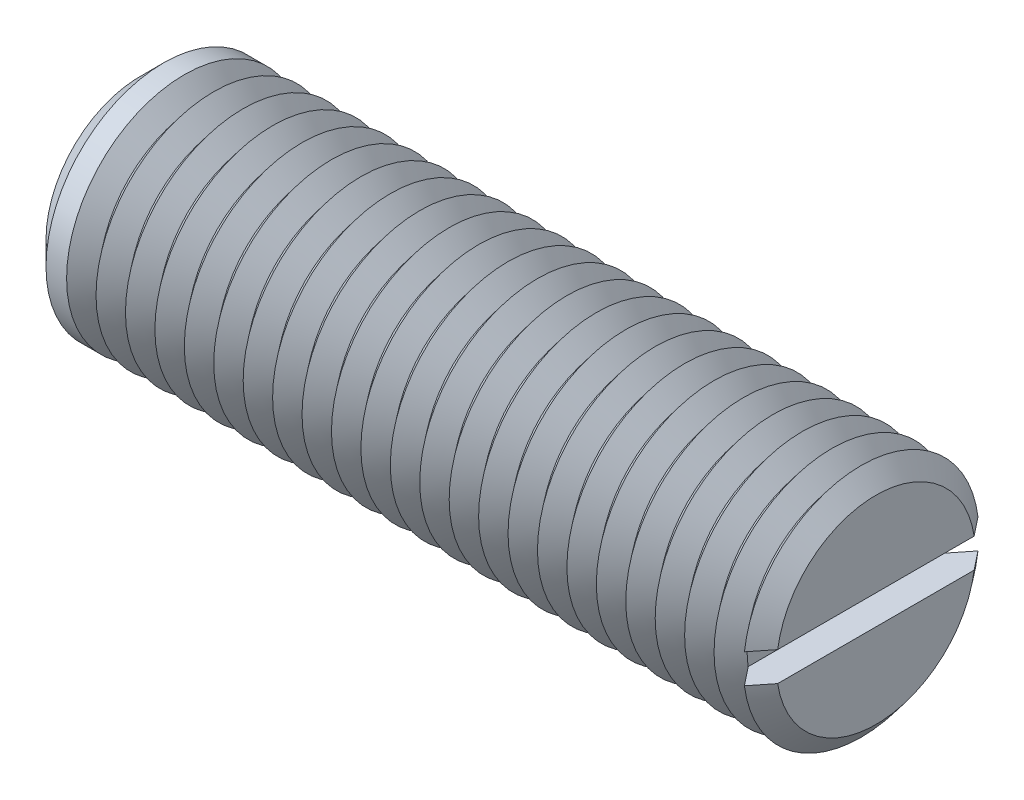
SolidWorks part; units mm, degrees
ref_plane "Front Plane" through (0, 0, 0) normal (0, 0, 1) x (1, 0, 0)
ref_plane "Top Plane" through (0, 0, 0) normal (0, 1, 0) x (1, 0, 0)
ref_plane "Right Plane" through (0, 0, 0) normal (1, 0, 0) x (0, 0, -1)
sketch "Sketch1" plane through (0, 0, 0) normal (1, 0, 0) x (0, 0, -1)
  circle A0 centre (0, 0) radius 8
  dimension "D1" = 16
extrude "Extrude1" add sketch "Sketch1" along normal mid plane 50
sketch "Sketch2" plane through (0, 0, 0) normal (0, 0, 1) x (1, 0, 0)
  line L0 (25, 1) -> (23, 1)
  line L1 (25, -8) -> (25, 8) construction
  line L2 (23, 1) -> (23, -1)
  line L3 (0, 0) -> (50000, 0) construction
  line L4 (25, -1) -> (23, -1)
  line L5 (25, -1) -> (25, 1)
  point P9 (23, 0)
  dimension "D1" = 2
extrude "Extrude2" cut sketch "Sketch2" against normal mid plane 24
chamfer "Chamfer1" distance 1.6 angle 45 1 edges at (-25, 0, -8)
sketch "Sketch3" plane through (0, 0, 0) normal (0, 0, 1) x (1, 0, 0)
  line L0 (0, 0) -> (30.9602, 0) construction
  line L1 (24, -8) -> (26, -8)
  line L2 (-23.4, -8) -> (25, -8) construction
  line L3 (26, -8) -> (25, -6.751)
  line L4 (25, -8) -> (25, -1) construction
  line L5 (25, -6.751) -> (24, -8)
  dimension "D1" = 2
  dimension "D2" = 1.6
revolve "Cut-Revolve1" cut sketch "Sketch3" angle 360 about L0
pattern_linear "LPattern1" count 24 spacing 2 along (-1, 0, 0) of "Cut-Revolve1"
equation "\"D2@Sketch3\" = \"D1@Sketch3\"*0.8"
